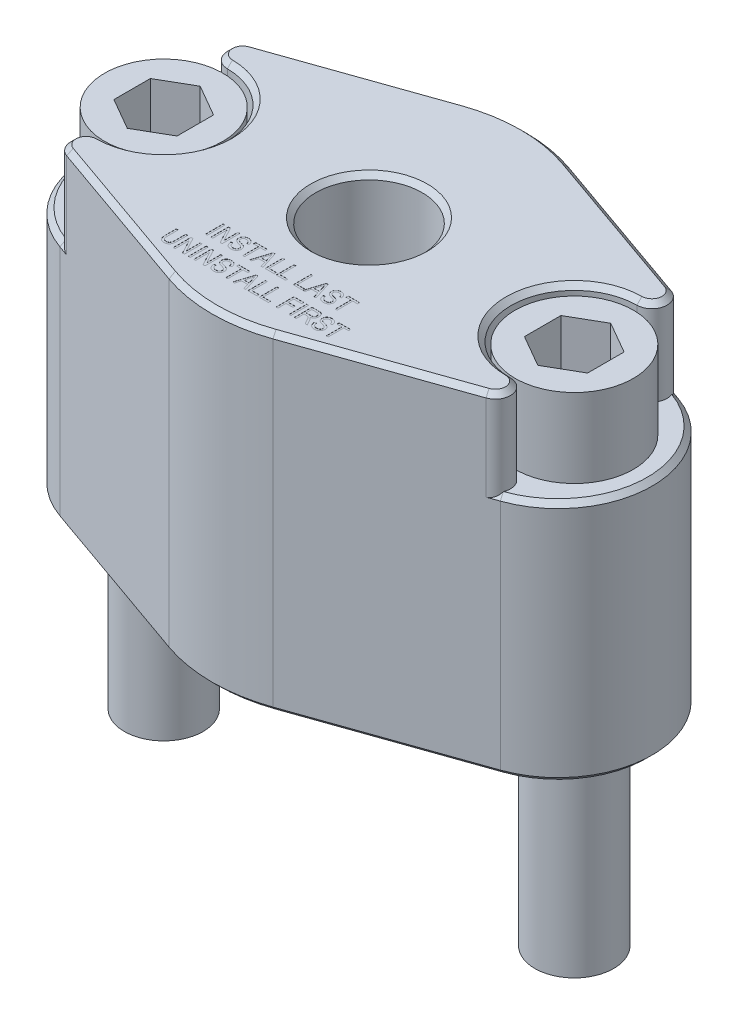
SolidWorks part; units mm, degrees
other "<SHCS31-18L1.75>-<HEX>"
ref_plane "Front Plane" through (0, 0, 0) normal (0, 0, 1) x (1, 0, 0)
ref_plane "Top Plane" through (0, 0, 0) normal (0, 1, 0) x (1, 0, 0)
ref_plane "Right Plane" through (0, 0, 0) normal (1, 0, 0) x (0, 0, -1)
sketch "Sketch1" plane through (0, 0, 0) normal (0, 1, 0) x (1, 0, 0)
  line L0 (-5.2297, 14.8812) -> (-22.1404, 8.9383)
  line L1 (-22.1404, -8.9383) -> (-5.2297, -14.8812)
  line L2 (5.2297, -14.8812) -> (22.1404, -8.9383)
  line L3 (22.1404, 8.9383) -> (5.2297, 14.8812)
  line L4 (-18.9992, 0) -> (18.9992, 0) construction
  line L5 (0, 0) -> (0, 22.9186) construction
  arc A0 (-5.2297, -14.8812) -> (5.2297, -14.8812) centre (0, 0) ccw
  arc A1 (-22.1404, 8.9383) -> (-22.1404, -8.9383) centre (-18.9992, 0) ccw
  arc A2 (22.1404, -8.9383) -> (22.1404, 8.9383) centre (18.9992, 0) ccw
  arc A3 (5.2297, 14.8812) -> (-5.2297, 14.8812) centre (0, 0) ccw
  circle A4 centre (-20.6375, 0) radius 4.3815
  circle A5 centre (20.6375, 0) radius 4.3815
  dimension "D1" = 31.5468
  dimension "D2" = 9.4742
  dimension "D3" = 56.9468
  dimension "D5" = 20.6375
  dimension "D6" = 8.763
  dimension "D4" = 19.363
extrude "Boss-Extrude1" add sketch "Sketch1" along normal blind 33.0708
sketch "Sketch2" plane through (0, 0, 0) normal (0, -1, 0) x (1, 0, 0)
  circle A0 centre (0, 0) radius 12.827
  dimension "D1" = 25.654
extrude "Cut-Extrude1" cut sketch "Sketch2" against normal blind 15.875
fillet "Fillet1" radius 0.508 1 edges at (0, 15.875, -12.827)
sketch "Sketch3" plane through (0, 33.0708, 0) normal (0, 1, 0) x (1, 0, 0)
  line L0 (-28.4734, 6.35) -> (-20.6375, 6.35)
  line L1 (-28.4734, -6.35) -> (-20.6375, -6.35)
  line L2 (-28.4734, 6.35) -> (-28.4734, -6.35)
  line L3 (20.6375, 6.35) -> (28.4734, 6.35)
  line L4 (28.4734, 6.35) -> (28.4734, -6.35)
  line L5 (28.4734, -6.35) -> (20.6375, -6.35)
  arc A0 (-20.6375, -6.35) -> (-20.6375, 6.35) centre (-20.6375, 0) ccw
  arc A1 (20.6375, 6.35) -> (20.6375, -6.35) centre (20.6375, 0) ccw
  arc A2 (-22.1404, 8.9383) -> (-22.1404, -8.9383) centre (-18.9992, 0) ccw construction
  arc A3 (22.1404, -8.9383) -> (22.1404, 8.9383) centre (18.9992, 0) ccw construction
  dimension "D1" = 12.7
extrude "Cut-Extrude2" cut sketch "Sketch3" against normal blind 8.636
fillet "Fillet2" radius 1.524 4 edges at (-26.0304, 28.7528, 6.35) (-26.0304, 28.7528, -6.35) (26.0304, 28.7528, 6.35) (26.0304, 28.7528, -6.35)
hole_wizard "1/2-13 Tapped Hole1" positions "Sketch4" profile "Sketch5" tap size "1/2-13" standard "ANSI Inch"
sketch "Sketch4" plane through (0, 33.0708, 0) normal (0, 1, 0) x (1, 0, 0)
  point P0 (0, 0)
sketch "Sketch5" plane through (0, 33.0708, 0) normal (1, 0, 0) x (0, 0, 1)
  line L0 (0, 0) -> (0, 33.0708)
  line L1 (0, 33.0708) -> (5.3581, 33.0708)
  line L2 (5.3581, 33.0708) -> (5.3581, 0)
  line L5 (5.3581, 0) -> (0, 0)
  line L11 (0, -6.35) -> (0, 107.95) construction
  dimension "Thru Tap Drill Dia." = 10.7163
  dimension "Thru Tap Drill Depth" = 33.0708
chamfer "Chamfer1" distance 0.508 angle 45 30 edges at (13.154, 33.0708, -12.0964) (13.154, 33.0708, 12.0964) (0, 33.0708, 15.7734) (-13.154, 33.0708, 12.0964) (-13.154, 33.0708, -12.0964) (0, 33.0708, -15.7734) (14.2875, 33.0708, 0) (-14.2875, 33.0708, 0) (0, 33.0708, 5.3581) (20.6375, 0, 4.3815) (0, 0, -12.827) (-20.6375, 0, 4.3815) (13.685, 0, -11.9098) (0, 0, -15.7734) (28.4734, 0, 0) (-13.685, 0, -11.9098) (13.685, 0, 11.9098) (-28.4734, 0, 0) (0, 0, 15.7734) (-13.685, 0, 11.9098) (-22.0764, 33.0708, 7.6236) (-22.0764, 33.0708, -7.6236) (22.0764, 33.0708, -7.6236) (22.0764, 33.0708, 7.6236) (21.6094, 24.4348, 9.1249) (21.6094, 24.4348, -9.1249) (28.4734, 24.4348, 0) (-21.6094, 24.4348, -9.1249) (-21.6094, 24.4348, 9.1249) (-28.4734, 24.4348, 0)
sketch "Sketch6" plane through (0, 33.0708, 0) normal (0, 1, 0) x (1, 0, 0)
  line L0 (-9.525, -9.652) -> (9.525, -9.652) construction
  line L1 (0, 15.2654) -> (0, -15.7734) construction
  line L3 (-9.525, -12.446) -> (9.525, -12.446) construction
  arc A0 (5.0613, 14.4019) -> (-5.0613, 14.4019) centre (0, 0) ccw construction
  arc A1 (-5.2297, -14.8812) -> (5.2297, -14.8812) centre (0, 0) ccw construction
  text T0 "INSTALL LAST" font "Arial Narrow" height 1.778
  text T2 "UNINSTALL FIRST" font "Arial Narrow" height 1.778
  point P14 (0, -9.652)
  dimension "D2" = 19.05
  dimension "D5" = 9.652
  dimension "D6" = 12.446
extrude "Cut-Extrude3" cut sketch "Sketch6" against normal blind 0.0127
inserted part "SHCS31-18L1.75"
move or copy body "Body-Move/Copy2" placed by mates yes parameters "D1"=0, "D2"=0, "D3"=0
mirror "Mirror1" about plane through (0, 0, 0) normal (1, 0, 0)
